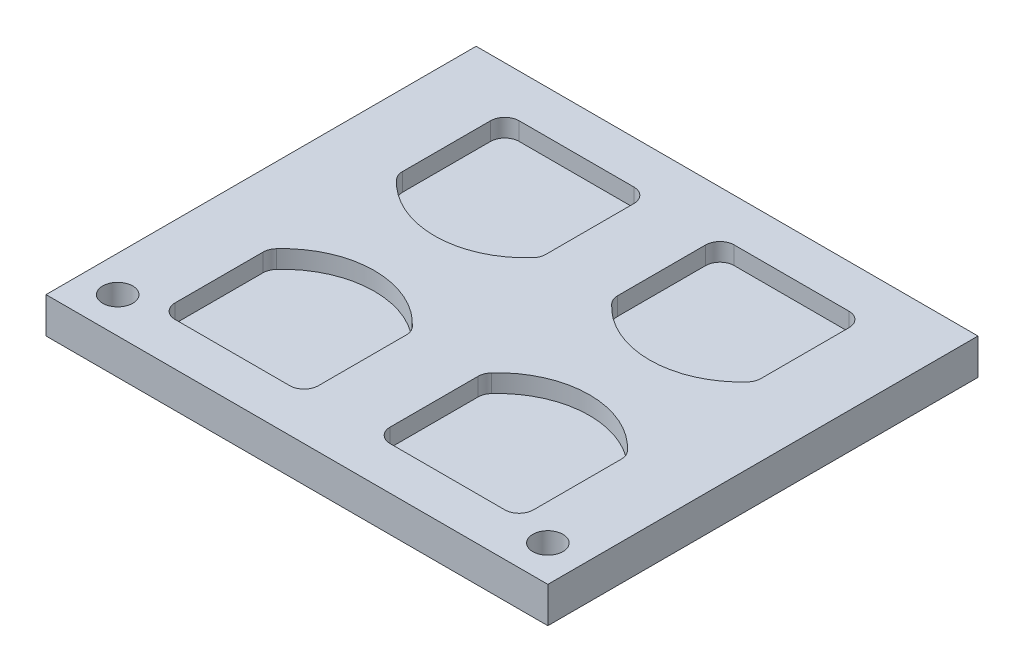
SolidWorks part; units mm, degrees
ref_plane "Front Plane" through (0, 0, 0) normal (0, 0, 1) x (1, 0, 0)
ref_plane "Top Plane" through (0, 0, 0) normal (0, 1, 0) x (1, 0, 0)
ref_plane "Right Plane" through (0, 0, 0) normal (1, 0, 0) x (0, 0, -1)
sketch "Sketch1" plane through (0, 0, 0) normal (0, 1, 0) x (1, 0, 0)
  line L1 (-175, -150) -> (175, -150)
  line L2 (-175, -150) -> (-175, 150)
  line L3 (-175, 150) -> (175, 150)
  line L4 (175, -150) -> (175, 150)
  line L5 (-175, -150) -> (175, 150) construction
  line L6 (-175, 150) -> (175, -150) construction
  point P0 (0, 0)
  dimension "D1" = 300
  dimension "D2" = 350
extrude "Boss-Extrude1" add sketch "Sketch1" along normal blind 25
sketch "Sketch2" plane through (0, 25, 0) normal (0, 1, 0) x (1, 0, 0)
  line L5 (-175, -150) -> (175, -150) construction
  line L6 (-125, -120) -> (-25, -120)
  line L10 (-125, -120) -> (-125, -45)
  line L13 (-125, -45) -> (-25, -45) construction
  line L14 (0, -13.75) -> (0, 13.75) construction
  line L15 (125, -45) -> (25, -45) construction
  line L16 (-25, -120) -> (-25, -45)
  line L17 (-175, 150) -> (-175, -150) construction
  line L18 (25, -120) -> (25, -45)
  line L19 (125, -120) -> (125, -45)
  line L20 (125, -120) -> (25, -120)
  line L21 (-13.75, 0) -> (13.75, 0) construction
  line L22 (125, 45) -> (25, 45) construction
  line L23 (-125, 45) -> (-25, 45) construction
  line L24 (125, 120) -> (25, 120)
  line L25 (125, 120) -> (125, 45)
  line L26 (25, 120) -> (25, 45)
  line L27 (-25, 120) -> (-25, 45)
  line L28 (-125, 120) -> (-125, 45)
  line L29 (-125, 120) -> (-25, 120)
  arc A1 (-25, -45) -> (-125, -45) centre (-75, -85) ccw
  arc A2 (25, -45) -> (125, -45) centre (75, -85) cw
  arc A3 (25, 45) -> (125, 45) centre (75, 85) ccw
  arc A4 (-25, 45) -> (-125, 45) centre (-75, 85) cw
  dimension "D1" = 30
  dimension "D2" = 50
  dimension "D3" = 100
  dimension "D4" = 35
  dimension "D5" = 75
extrude "Cut-Extrude1" cut sketch "Sketch2" against normal blind 12.5
hole_wizard "M24x3.0 Tapped Hole1" positions "Sketch3" profile "Sketch4" tap size "M24x3.0" standard "ANSI Metric"
sketch "Sketch3" plane through (0, 25, 0) normal (0, 1, 0) x (1, 0, 0)
  line L0 (-175, -150) -> (175, -150) construction
  line L1 (-175, 150) -> (-175, -150) construction
  line L2 (175, -150) -> (175, 150) construction
  point P0 (-150, -125)
  point P2 (150, -125)
  dimension "D1" = 25
  dimension "D2" = 25
  dimension "D3" = 25
  dimension "D4" = 25
sketch "Sketch4" plane through (-150, 25, 125) normal (1, 0, 0) x (0, 0, 1)
  line L0 (0, 0) -> (0, 25)
  line L1 (0, 25) -> (10.5, 25)
  line L2 (10.5, 25) -> (10.5, 0)
  line L5 (10.5, 0) -> (0, 0)
  line L11 (0, -6.35) -> (0, 107.95) construction
  dimension "Thru Tap Drill Dia." = 21
  dimension "Thru Tap Drill Depth" = 25
fillet "Fillet1" radius 10 16 edges at (25, 18.75, -45) (25, 18.75, -120) (125, 18.75, -120) (125, 18.75, -45) (25, 18.75, 120) (125, 18.75, 120) (125, 18.75, 45) (25, 18.75, 45) (-125, 18.75, 120) (-25, 18.75, 120) (-25, 18.75, 45) (-125, 18.75, 45) (-125, 18.75, -45) (-25, 18.75, -45) (-25, 18.75, -120) (-125, 18.75, -120)
